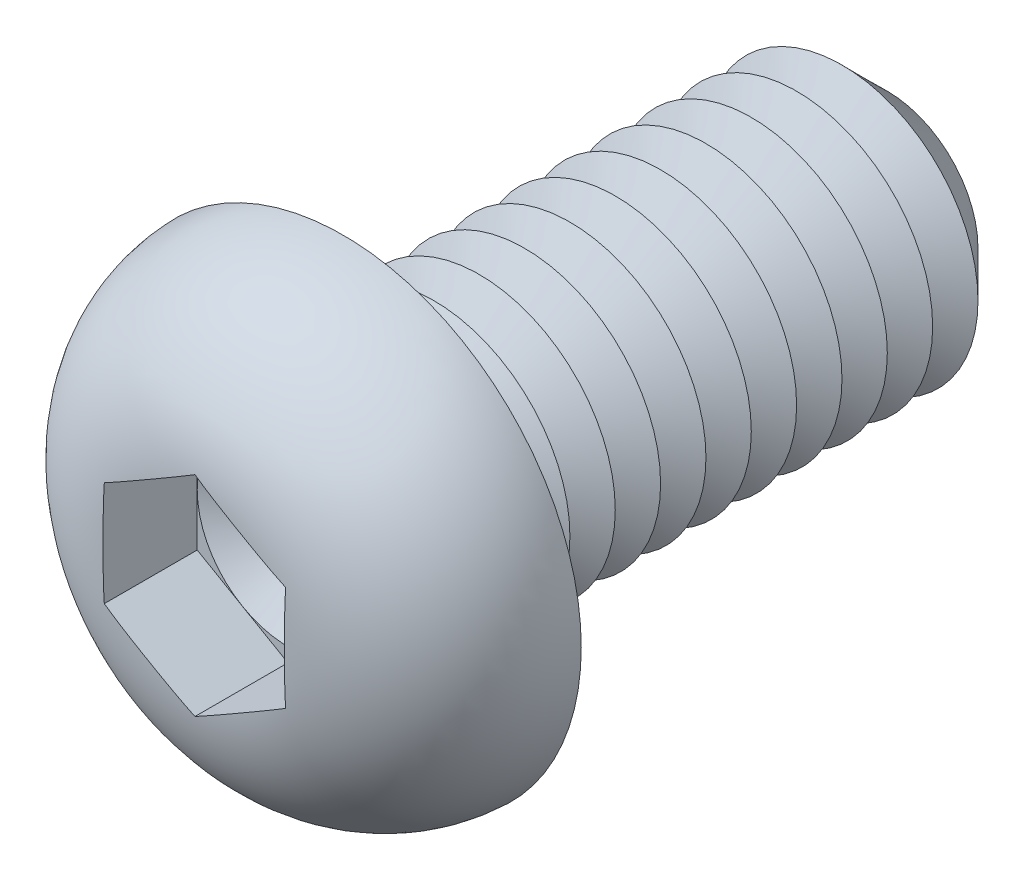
SolidWorks part; units mm, degrees
ref_plane "Front Plane" through (0, 0, 0) normal (0, 0, 1) x (1, 0, 0)
ref_plane "Top Plane" through (0, 0, 0) normal (0, 1, 0) x (1, 0, 0)
ref_plane "Right Plane" through (0, 0, 0) normal (1, 0, 0) x (0, 0, -1)
sketch "Sketch1" plane through (0, 0, 0) normal (1, 0, 0) x (0, 0, -1)
  line L0 (-47.9342, 0) -> (60.3146, 0) construction
sketch "Sketch2" plane through (0, 0, 0) normal (1, 0, 0) x (0, 0, -1)
  line L0 (0, 0) -> (-3.3, 0)
  line L1 (-47.9342, 0) -> (60.3146, 0) construction
  line L2 (-3.3, 0) -> (-3.3, 1.8515)
  line L3 (0, 5.25) -> (0, 0)
  arc A0 (-3.3, 1.8515) -> (0, 5.25) centre (0.1, 1.8515) cw
  dimension "D1" = 3.4
  dimension "D2" = 3.3
  dimension "D3" = 5.25
revolve "Revolve1" add sketch "Sketch2" angle 360 about L0
sketch "Sketch3" plane through (0, 0, 3.3) normal (0, 0, 1) x (1, 0, 0)
  line L1 (0, 2.3094) -> (-2, 1.1547)
  line L2 (-2, 1.1547) -> (-2, -1.1547)
  line L3 (-2, -1.1547) -> (0, -2.3094)
  line L4 (0, -2.3094) -> (2, -1.1547)
  line L5 (2, -1.1547) -> (2, 1.1547)
  line L6 (2, 1.1547) -> (0, 2.3094)
  circle A0 centre (0, 0) radius 2 construction
  dimension "D1" = 4
extrude "Cut-Extrude1" cut sketch "Sketch3" against normal blind 2.08
sketch "Sketch4" plane through (0, 0, 0) normal (0, 0, -1) x (-1, 0, 0)
  circle A0 centre (0, 0) radius 3
  dimension "D1" = 6
extrude "Boss-Extrude1" add sketch "Sketch4" along normal blind 12
chamfer "Chamfer1" distance 1 angle 45 1 edges at (-3, 0, -12)
sketch "Sketch5" plane through (0, 0, 0) normal (1, 0, 0) x (0, 0, -1)
  line L0 (1, 3) -> (2, 3)
  line L1 (11, 3) -> (0, 3) construction
  line L2 (2, 3) -> (1.5, 2.134)
  line L3 (1.5, 2.134) -> (1, 3)
  line L4 (0, -5.25) -> (0, 5.25) construction
  line L5 (11, 3) -> (0, 3) construction
  dimension "D1" = 1
  dimension "D2" = 1
revolve "Cut-Revolve1" cut sketch "Sketch5" angle 360 about L0
pattern_linear "LPattern1" count 10 spacing 1 along (0, 0, -1) of "Cut-Revolve1"
fillet "Fillet2" radius 0.5 1 edges at (-3, 0, 0)
sketch "Sketch6" plane through (0, 0, 1.22) normal (0, 0, 1) x (1, 0, 0)
  line L0 (0, -2.3094) -> (2, -1.1547) construction
  circle A0 centre (0, 0) radius 2
extrude "Cut-Extrude2" cut sketch "Sketch6" against normal through all draft 60
